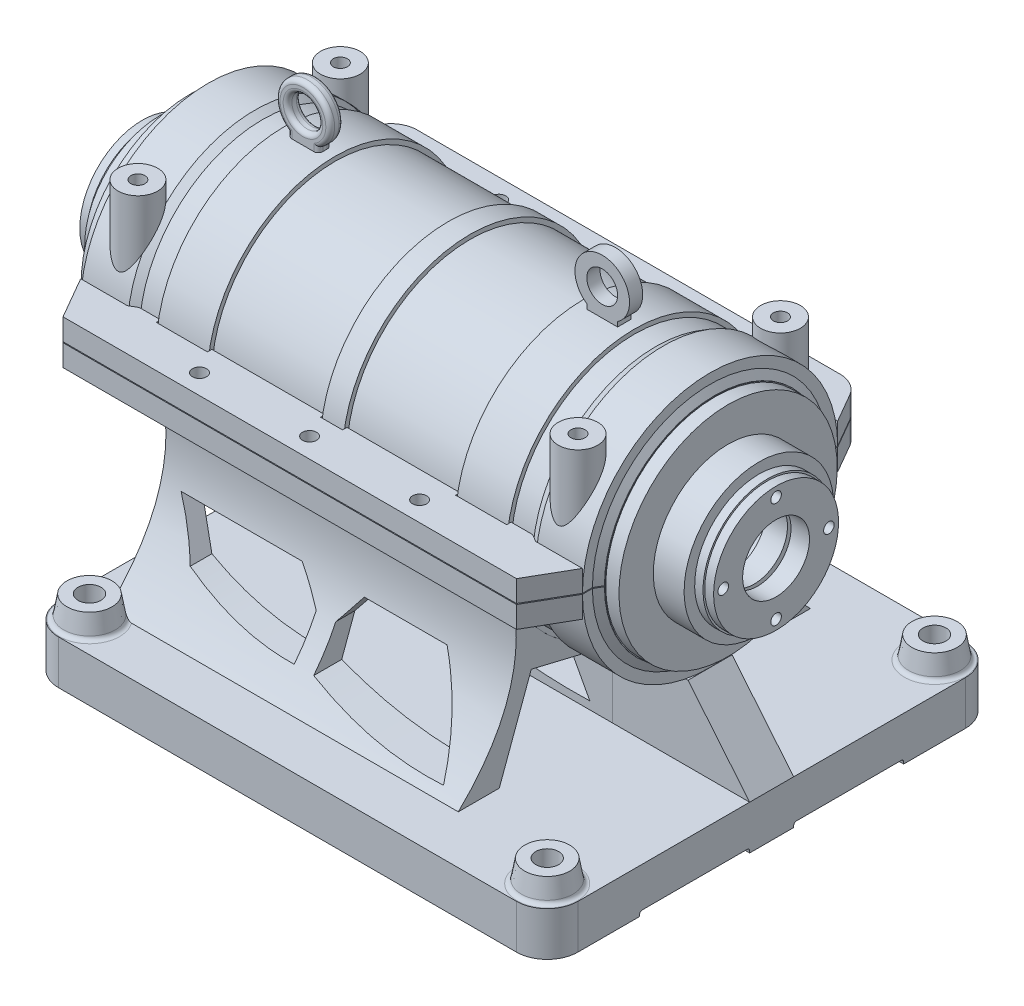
SolidWorks part; units mm, degrees
ref_plane "Front Plane" through (0, 0, 0) normal (0, 0, 1) x (1, 0, 0)
ref_plane "Top Plane" through (0, 0, 0) normal (0, 1, 0) x (1, 0, 0)
ref_plane "Right Plane" through (0, 0, 0) normal (1, 0, 0) x (0, 0, -1)
sketch "Sketch1" plane through (0, 0, 0) normal (0, 0, 1) x (1, 0, 0)
  line L0 (-90, 90) -> (-148, 90)
  line L1 (-90, 90) -> (-90, 85)
  line L2 (-148, 90) -> (-148, 125)
  line L3 (-90, 85) -> (0, 85)
  line L4 (-148, 125) -> (-432, 125)
  line L5 (0, 85) -> (0, 125)
  line L6 (-277.5, 145) -> (-277.5, 140)
  line L7 (0, 125) -> (-5, 133.6603)
  line L8 (-5, 133.6603) -> (-5, 145)
  line L9 (-5, 145) -> (-58, 145)
  line L10 (-58, 145) -> (-66.6603, 140)
  line L11 (-66.6603, 140) -> (-91, 140)
  line L12 (-91, 140) -> (-91, 145)
  line L13 (0, 0) -> (-570, 0) construction
  line L14 (-91, 145) -> (-149, 145)
  line L15 (-149, 145) -> (-149, 140)
  line L16 (-149, 140) -> (-277.5, 140)
  line L17 (-290, 145) -> (-290, 125) construction
  line L18 (-302.5, 145) -> (-277.5, 145)
  line L19 (-431, 140) -> (-302.5, 140)
  line L20 (-431, 145) -> (-431, 140)
  line L21 (-489, 145) -> (-431, 145)
  line L22 (-489, 140) -> (-489, 145)
  line L23 (-513.3397, 140) -> (-489, 140)
  line L24 (-522, 145) -> (-513.3397, 140)
  line L25 (-575, 145) -> (-522, 145)
  line L26 (-575, 133.6603) -> (-575, 145)
  line L27 (-580, 125) -> (-575, 133.6603)
  line L28 (-302.5, 145) -> (-302.5, 140)
  line L29 (-580, 85) -> (-580, 125)
  line L30 (-490, 85) -> (-580, 85)
  line L31 (-432, 90) -> (-432, 125)
  line L32 (-490, 90) -> (-490, 85)
  line L33 (-490, 90) -> (-432, 90)
  dimension "D1" = 85
  dimension "D2" = 90
  dimension "D3" = 90
  dimension "D4" = 58
  dimension "D5" = 145
  dimension "D6" = 125
  dimension "D7" = 140
  dimension "D8" = 5
  dimension "D9" = 53
  dimension "D10" = 33
  dimension "D11" = 58
  dimension "D12" = 125
  dimension "D13" = 290
  dimension "D14" = 30
  dimension "D15" = 30
  dimension "D16" = 12.5
  dimension "D17" = 25
revolve "Revolve1" add sketch "Sketch1" angle 360 about L13
ref_plane "Plane1" through (0, -280, 0) normal (0, 1, 0) x (1, 0, 0)
sketch "Sketch2" plane through (0, -280, 0) normal (0, 1, 0) x (1, 0, 0)
  line L0 (0, 0) -> (-230, 0) construction
  line L1 (-490, -255) -> (30, -255)
  line L2 (-525, -220) -> (-525, 220)
  line L3 (-490, 255) -> (30, 255)
  line L4 (65, -220) -> (65, 220)
  line L5 (-525, -255) -> (65, 255) construction
  line L6 (-525, 255) -> (65, -255) construction
  line L7 (0, -125) -> (0, 125) construction
  arc A0 (-490, -255) -> (-525, -220) centre (-490, -220) cw
  arc A1 (30, -255) -> (65, -220) centre (30, -220) ccw
  arc A2 (30, 255) -> (65, 220) centre (30, 220) cw
  arc A3 (-525, 220) -> (-490, 255) centre (-490, 220) cw
  point P0 (-230, 0)
  dimension "D4" = 35
  dimension "D1" = 510
  dimension "D2" = 590
  dimension "D3" = 65
extrude "Boss-Extrude1" add sketch "Sketch2" along normal blind 50 separate body
sketch "Sketch3" plane through (0, -230, 0) normal (0, 1, 0) x (1, 0, 0)
  line L0 (30, 0) -> (65, 0) construction
  line L1 (30, 220) -> (-490, 220) construction
  line L2 (30, 220) -> (30, -220) construction
  line L3 (30, -220) -> (-490, -220) construction
  line L4 (-490, 220) -> (-490, -220) construction
  line L5 (65, -220) -> (65, 220) construction
  circle A0 centre (30, 220) radius 30
  circle A1 centre (-490, 220) radius 30
  circle A2 centre (30, -220) radius 30
  circle A3 centre (-490, -220) radius 30
  dimension "D1" = 60
  dimension "D2" = 35
  dimension "D3" = 440
  dimension "D4" = 520
extrude "Boss-Extrude2" add sketch "Sketch3" along normal blind 25 draft 10
sketch "Sketch4" plane through (0, 0, 0) normal (0, 1, 0) x (1, 0, 0)
  line L0 (-547.5759, 192.5) -> (-32.4241, 192.5)
  line L1 (-5, 145) -> (-32.4241, 192.5)
  line L2 (-575, 145) -> (-547.5759, 192.5)
  line L3 (-575, 145) -> (-522, 145)
  line L4 (-522, 145) -> (-522, -145) construction
  line L5 (-522, 145) -> (-513.3397, 140)
  line L6 (-489, 140) -> (-513.3397, 140) construction
  line L7 (-513.3397, 140) -> (-522, 145) construction
  line L8 (-513.3397, 140) -> (-489, 140)
  line L9 (-489, 145) -> (-489, -145) construction
  line L10 (-489, 140) -> (-489, 145)
  line L11 (-489, 145) -> (-431, 145)
  line L12 (-431, 145) -> (-431, 140)
  line L13 (-431, -145) -> (-431, 145) construction
  line L14 (-431, 140) -> (-302.5, 140)
  line L15 (-302.5, 140) -> (-302.5, 145)
  line L16 (-302.5, 145) -> (-277.5, 145)
  line L17 (-277.5, 145) -> (-277.5, 140)
  line L18 (-277.5, -145) -> (-277.5, 145) construction
  line L19 (-149, 140) -> (-277.5, 140) construction
  line L20 (-277.5, 140) -> (-149, 140)
  line L21 (-149, 140) -> (-149, 145)
  line L22 (-149, 145) -> (-91, 145)
  line L23 (-91, 145) -> (-91, 140)
  line L24 (-91, 140) -> (-66.6603, 140)
  line L25 (-66.6603, 140) -> (-91, 140) construction
  line L26 (-66.6603, 140) -> (-58, 145)
  line L27 (-58, 145) -> (-5, 145)
  line L28 (0, 0) -> (-580, 0) construction
  line L29 (-580, 125) -> (-580, -125) construction
  line L30 (-58, 145) -> (-66.6603, 140) construction
  line L31 (-58, -145) -> (-5, -145)
  line L32 (-66.6603, -140) -> (-58, -145)
  line L33 (-91, -140) -> (-66.6603, -140)
  line L34 (-91, -145) -> (-91, -140)
  line L35 (-149, -145) -> (-91, -145)
  line L36 (-149, -140) -> (-149, -145)
  line L37 (-277.5, -140) -> (-149, -140)
  line L38 (-277.5, -145) -> (-277.5, -140)
  line L39 (-302.5, -145) -> (-277.5, -145)
  line L40 (-302.5, -140) -> (-302.5, -145)
  line L41 (-431, -140) -> (-302.5, -140)
  line L42 (-431, -145) -> (-431, -140)
  line L43 (-489, -145) -> (-431, -145)
  line L44 (-489, -140) -> (-489, -145)
  line L45 (-513.3397, -140) -> (-489, -140)
  line L46 (-522, -145) -> (-513.3397, -140)
  line L47 (-575, -145) -> (-522, -145)
  line L48 (-575, -145) -> (-547.5759, -192.5)
  line L49 (-5, -145) -> (-32.4241, -192.5)
  line L50 (-547.5759, -192.5) -> (-32.4241, -192.5)
  dimension "D1" = 60
  dimension "D2" = 192.5
extrude "Boss-Extrude5" add sketch "Sketch4" along normal mid plane 50 separate body
fillet "Fillet1" radius 30 2 edges at (-547.5759, 0, -192.5) (-32.4241, 0, -192.5)
ref_plane "Plane2" through (0, 0, 260) normal (0, 0, 1) x (1, 0, 0)
sketch "Sketch5" plane through (-91, 0, 0) normal (1, 0, 0) x (0, 0, -1)
  line L0 (-220, -230) -> (220, -230) construction
  line L2 (0, 0) -> (0, -230) construction
  line L3 (200, -230) -> (153.4621, -230)
  line L4 (145, -25) -> (142.8286, -25)
  line L5 (-145, -25) -> (-142.8286, -25)
  line L6 (-135.9517, -114.7725) -> (135.9517, -114.7725) construction
  line L7 (-117.0735, -131.1167) -> (-153.4621, -230)
  line L8 (25, -230) -> (-25, -230)
  line L9 (-25, -230) -> (-25, -153.3076)
  line L10 (-25, -153.3076) -> (-117.0735, -131.1167)
  line L11 (25, -153.3076) -> (117.0735, -131.1167)
  line L12 (25, -230) -> (25, -153.3076)
  line L14 (117.0735, -131.1167) -> (153.4621, -230)
  line L15 (-153.4621, -230) -> (-200, -230)
  circle A0 centre (0, 0) radius 145 construction
  arc A1 (-142.8286, -25) -> (142.8286, -25) centre (0, 0) ccw
  spline S0 degree 2 poles (-200, -230) (-107.4237, -140.9243) (-145, -25) knots 0 0 0 1 1 1
  spline S1 degree 2 poles (200, -230) (107.4237, -140.9243) (145, -25) knots 0 0 0 1 1 1
  dimension "D1" = 400
  dimension "D2" = 225.3632
  dimension "D3" = 50
extrude "Boss-Extrude8" add sketch "Sketch5" against normal up to surface (398 mm away) separate body
sketch "Sketch6" plane through (0, 0, 0) normal (0, 0, 1) x (1, 0, 0)
  line L0 (-5, -145) -> (-58, -145)
  line L1 (-58, -145) -> (-66.6603, -140)
  line L2 (-66.6603, -140) -> (-91, -140)
  line L3 (-91, -140) -> (-91, -230)
  line L4 (-91, -230) -> (-91, -25) construction
  line L5 (-91, -230) -> (65, -230)
  line L6 (65, -230) -> (65, -280) construction
  line L7 (65, -230) -> (30, -230) construction
  line L9 (65, -230) -> (-5, -145)
  line L10 (-575, -145) -> (-522, -145)
  line L11 (-522, -145) -> (-513.3397, -140)
  line L12 (-513.3397, -140) -> (-489, -140)
  line L13 (-489, -140) -> (-489, -230)
  line L14 (-490, -230) -> (30, -230) construction
  line L15 (-489, -25) -> (-489, -230) construction
  line L16 (-489, -230) -> (-525, -230)
  line L17 (-525, -230) -> (-575, -145)
extrude "Boss-Extrude10" add sketch "Sketch6" along normal mid plane 50 separate body
sketch "Sketch8" plane through (0, 0, 260) normal (0, 0, 1) x (1, 0, 0)
  line L0 (-435.5965, -180.7227) -> (-466.4049, -132.5771)
  line L2 (-466.4049, -132.5771) -> (-328.8184, -132.5771)
  line L3 (-328.8184, -132.5771) -> (-302.1902, -162.3729)
  line L4 (-302.1902, -162.3729) -> (-302.1902, -202.8121)
  line L6 (-280.002, -202.8121) -> (-280.002, -162.3729)
  line L7 (-280.002, -162.3729) -> (-258.2705, -132.5771)
  line L8 (-258.2705, -132.5771) -> (-164.2729, -132.5771)
  line L9 (-164.2729, -132.5771) -> (-116.5858, -221.1387)
  spline S0 degree 2 poles (-435.5965, -180.7227) (-371.1308, -203.7255) (-302.1902, -202.8121) knots 0 0 0 1 1 1
  spline S1 degree 2 poles (-116.5858, -221.1387) (-199.6367, -223.7851) (-280.002, -202.8121) knots 0 0 0 1 1 1
extrude "Cut-Extrude1" cut sketch "Sketch8" against normal up to surface (377.6109 mm away)
sketch "Sketch9" plane through (-580, 0, 0) normal (-1, 0, 0) x (0, 0, 1)
  line L0 (192.5, 25) -> (192.5, -25) construction
  line L1 (-192.5, -0.5) -> (192.5, -0.5)
  line L2 (-192.5, -0.5) -> (-192.5, 0.5)
  line L3 (-192.5, 0.5) -> (192.5, 0.5)
  line L4 (192.5, -0.5) -> (192.5, 0.5)
  line L5 (-192.5, -0.5) -> (192.5, 0.5) construction
  line L6 (-192.5, 0.5) -> (192.5, -0.5) construction
  point P0 (0, 0)
  dimension "D1" = 1
extrude "Cut-Extrude2" cut sketch "Sketch9" against normal through all
fillet "Fillet2" radius 5 4 edges at (30, -230, 190) (30, -230, -250) (-490, -230, 190) (-490, -230, -250)
mirror "Mirror7" about plane through (0, 0, 0) normal (0, 0, 1) of "Cut-Extrude1"
sketch "Sketch10" plane through (0, 25, 0) normal (0, 1, 0) x (1, 0, 0)
  line L0 (-290, 192.5) -> (-290, 170) construction
  line L1 (-49.7446, 192.5) -> (-530.2554, 192.5) construction
  line L2 (-415, 170) -> (-290, 170) construction
  line L3 (-290, 170) -> (-165, 170) construction
  circle A0 centre (-290, 170) radius 8
  circle A1 centre (-165, 170) radius 8
  circle A2 centre (-415, 170) radius 8
  dimension "D1" = 16
  dimension "D3" = 125
  dimension "D2" = 170
  dimension "D4" = 125
extrude "Cut-Extrude3" cut sketch "Sketch10" against normal up to surface (50 mm away)
ref_plane "Plane3" through (0, 125, 0) normal (0, 1, 0) x (1, 0, 0)
sketch "Sketch11" plane through (0, 125, 0) normal (0, 1, 0) x (1, 0, 0)
  line L0 (-290, 170) -> (-290, 192.5) construction
  line L1 (-49.7446, 192.5) -> (-530.2554, 192.5) construction
  circle A0 centre (-40, 115) radius 22.5
  circle A1 centre (-40, 115) radius 8
  dimension "D1" = 45
  dimension "D4" = 16
  dimension "D2" = 115
  dimension "D3" = 250
extrude "Boss-Extrude11" add sketch "Sketch11" against normal up to surface (78.9701 mm away)
pattern_linear "LPattern1" count 2 spacing 230 along (0, 0, -1) count 2 spacing 500 along (-1, 0, 0) of "Boss-Extrude11"
sketch "Sketch12" plane through (0, 0, 0) normal (0, 0, 1) x (1, 0, 0)
  line L0 (-460, 176) -> (-460, 145) construction
  line L1 (-431, 145) -> (-489, 145) construction
  line L2 (-477.5, 145) -> (-442.5, 145)
  line L3 (-442.5, 150.4119) -> (-442.5, 145)
  line L4 (-477.5, 150.4119) -> (-477.5, 145)
  circle A0 centre (-460, 176) radius 17.5
  arc A1 (-442.5, 150.4119) -> (-477.5, 150.4119) centre (-460, 176) ccw
  dimension "D1" = 62
  dimension "D2" = 35
  dimension "D3" = 31
  dimension "D4" = 35
  dimension "D5" = 5.4119
extrude "Boss-Extrude12" add sketch "Sketch12" along normal mid plane 15 separate body
fillet "Fillet3" radius 5 8 edges at (-477.5, 147.706, -7.5) (-477.5, 147.706, 7.5) (-442.5, 147.706, -7.5) (-442.5, 147.706, 7.5) (-442.5, 176, -7.5) (-442.5, 176, 7.5) (-460, 207, -7.5) (-460, 207, 7.5)
pattern_linear "LPattern2" count 2 spacing 340 along (1, 0, 0) of "Boss-Extrude12"
mirror "Mirror8" about plane through (0, 0, 0) normal (0, 0, 1) of "Cut-Extrude3"
sketch "Sketch14" plane through (0, 0, 0) normal (0, 0, 1) x (1, 0, 0)
  line L0 (0, 0) -> (-621.8142, 0) construction
  line L1 (-580, 125) -> (-580.5, 125)
  line L2 (-580, 125) -> (-580, 85)
  line L3 (-580, 85) -> (-580.5, 85)
  line L4 (-580.5, 125) -> (-580.5, 85)
  dimension "D1" = 0.5
  dimension "D2" = 85
revolve "Revolve2" add sketch "Sketch14" angle 360 about L0
sketch "Sketch15" plane through (0, 0, 0) normal (0, 0, 1) x (1, 0, 0)
  line L0 (-580.5, 124) -> (-595.5, 124)
  line L2 (-595.5, 124) -> (-595.5, 85)
  line L3 (-595.5, 85) -> (-630.5, 85)
  line L4 (-630.5, 85) -> (-630.5, 73)
  line L5 (-630.5, 73) -> (-640, 73)
  line L6 (-640, 73) -> (-640, 47)
  line L7 (-640, 47) -> (-625, 47)
  line L8 (-625, 47) -> (-625, 38)
  line L9 (-625, 38) -> (-600, 38)
  line L10 (-600, 38) -> (-600, 58)
  line L11 (-600, 58) -> (-605, 58)
  line L12 (-605, 58) -> (-605, 53)
  line L13 (-605, 53) -> (-610, 53)
  line L14 (-610, 53) -> (-610, 70.7433)
  line L15 (-580.5, 124) -> (-580.5, 85)
  line L17 (-580.5, 85) -> (-569.5, 85)
  line L18 (-569.5, 85) -> (-569.5, 75)
  line L19 (-569.5, 75) -> (-610, 70.7433)
  line L20 (-580.5, 125) -> (-580.5, -125) construction
  line L21 (0, 0) -> (-665.287, 0) construction
  dimension "D1" = 11
  dimension "D2" = 15
  dimension "D3" = 59.5
  dimension "D4" = 85
  dimension "D5" = 73
  dimension "D6" = 47
  dimension "D7" = 38
  dimension "D8" = 96
  dimension "D9" = 35
  dimension "D10" = 40
  dimension "D11" = 20
  dimension "D12" = 5
  dimension "D13" = 5
  dimension "D14" = 10
  dimension "D15" = 15
  dimension "D16" = 15
  dimension "D17" = 39
revolve "Revolve3" add sketch "Sketch15" angle 360 about L21
sketch "Sketch16" plane through (0, 0, 0) normal (0, 0, 1) x (1, 0, 0)
  line L0 (-640, 71) -> (-650, 71)
  line L1 (-650, 71) -> (-650, 38)
  line L2 (-650, 38) -> (-629, 38)
  line L3 (-629, 38) -> (-629, 47)
  line L4 (-629, 47) -> (-640, 47)
  line L5 (-640, 73) -> (-640, -73) construction
  line L6 (-640, 47) -> (-640, 71)
  line L8 (-640, 0) -> (-630.5, 0) construction
  line L9 (-630.5, 85) -> (-630.5, -85) construction
  dimension "D1" = 10
  dimension "D2" = 38
  dimension "D3" = 47
  dimension "D4" = 11
  dimension "D5" = 71
revolve "Revolve4" add sketch "Sketch16" angle 360 about L8
sketch "Sketch17" plane through (-650, 0, 0) normal (-1, 0, 0) x (0, 0, 1)
  line L0 (0, 0) -> (0, 60) construction
  circle A0 centre (0, 60) radius 6
  dimension "D2" = 12
  dimension "D1" = 60
extrude "Cut-Extrude4" cut sketch "Sketch17" against normal blind 25 contours A0
pattern_circular "CirPattern1" count 4 over 360 about axis through (0, 0, 0) along (1, 0, 0) of "Cut-Extrude4"
ref_plane "Plane4" through (-290, 0, 0) normal (1, 0, 0) x (0, 0, -1)
mirror "Mirror9" about plane through (-290, 0, 0) normal (1, 0, 0) of "Revolve2", "Revolve3", "Revolve4", "Cut-Extrude4", "CirPattern1"
sketch "Sketch18" plane through (0, -205, 0) normal (0, 1, 0) x (1, 0, 0)
  circle A0 centre (-490, -220) radius 13
  dimension "D1" = 26
extrude "Cut-Extrude5" cut sketch "Sketch18" against normal through all
pattern_linear "LPattern3" count 2 spacing 520 along (1, 0, 0) count 2 spacing 440 along (0, 0, -1) of "Cut-Extrude5"
sketch "Sketch19" plane through (-525, 0, 0) normal (-1, 0, 0) x (0, 0, 1)
  line L0 (-220, -280) -> (220, -280) construction
  line L1 (150, -280) -> (25, -280)
  line L2 (150, -280) -> (150, -278)
  line L3 (147, -275) -> (28, -275)
  line L4 (25, -280) -> (25, -278)
  line L5 (0, -280) -> (0, -230) construction
  line L6 (25, -230) -> (-25, -230) construction
  line L7 (-25, -280) -> (-25, -278)
  line L8 (-147, -275) -> (-28, -275)
  line L9 (-150, -280) -> (-150, -278)
  line L10 (-150, -280) -> (-25, -280)
  arc A0 (150, -278) -> (147, -275) centre (147, -278) ccw
  arc A1 (28, -275) -> (25, -278) centre (28, -278) ccw
  arc A2 (-28, -275) -> (-25, -278) centre (-28, -278) cw
  arc A3 (-150, -278) -> (-147, -275) centre (-147, -278) cw
  point P12 (150, -275)
  point P23 (-150, -275)
  dimension "D4" = 3
  dimension "D1" = 125
  dimension "D2" = 25
  dimension "D3" = 5
extrude "Cut-Extrude6" cut sketch "Sketch19" against normal through all
